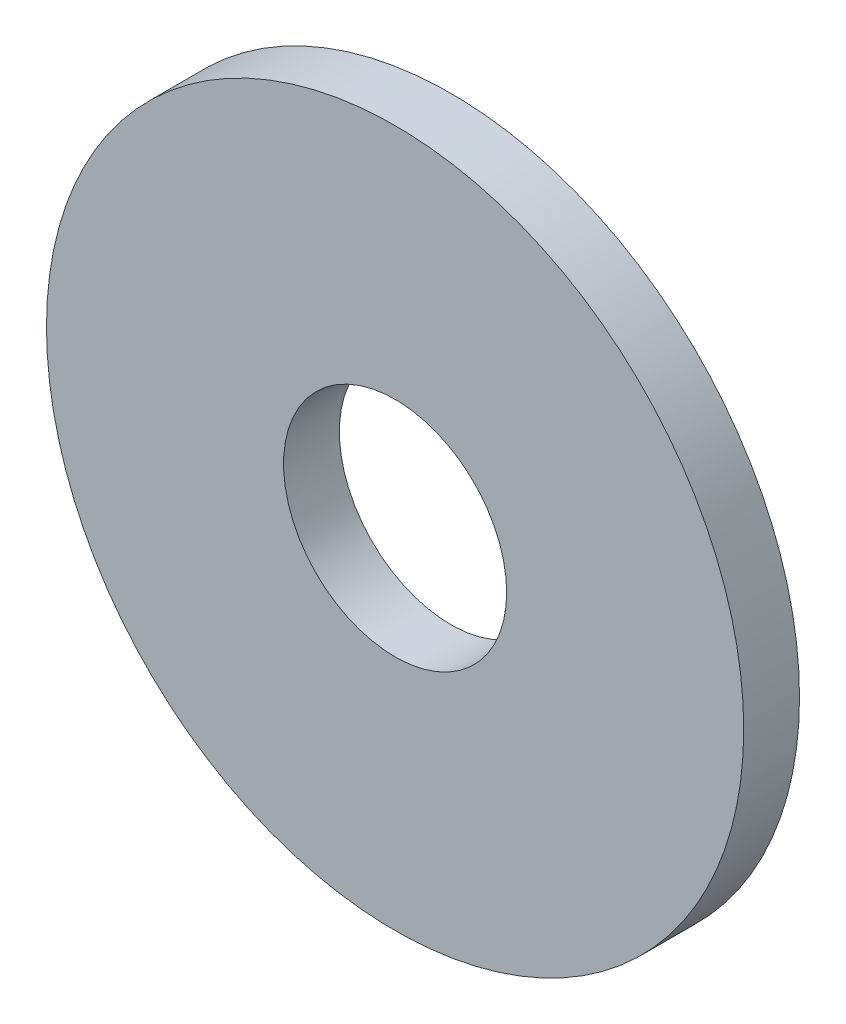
SolidWorks part; units mm, degrees
ref_plane "Front" through (0, 0, 0) normal (0, 0, 1) x (1, 0, 0)
ref_plane "Top" through (0, 0, 0) normal (0, 1, 0) x (1, 0, 0)
ref_plane "Right" through (0, 0, 0) normal (1, 0, 0) x (0, 0, -1)
sketch "Sketch1" plane through (0, 0, 0) normal (0, 0, 1) x (1, 0, 0)
  circle A0 centre (0, 0) radius 4
  circle A1 centre (0, 0) radius 12.5
  dimension "D1" = 25
  dimension "D2" = 8
extrude "Base-Extrude" add sketch "Sketch1" along normal blind 2
